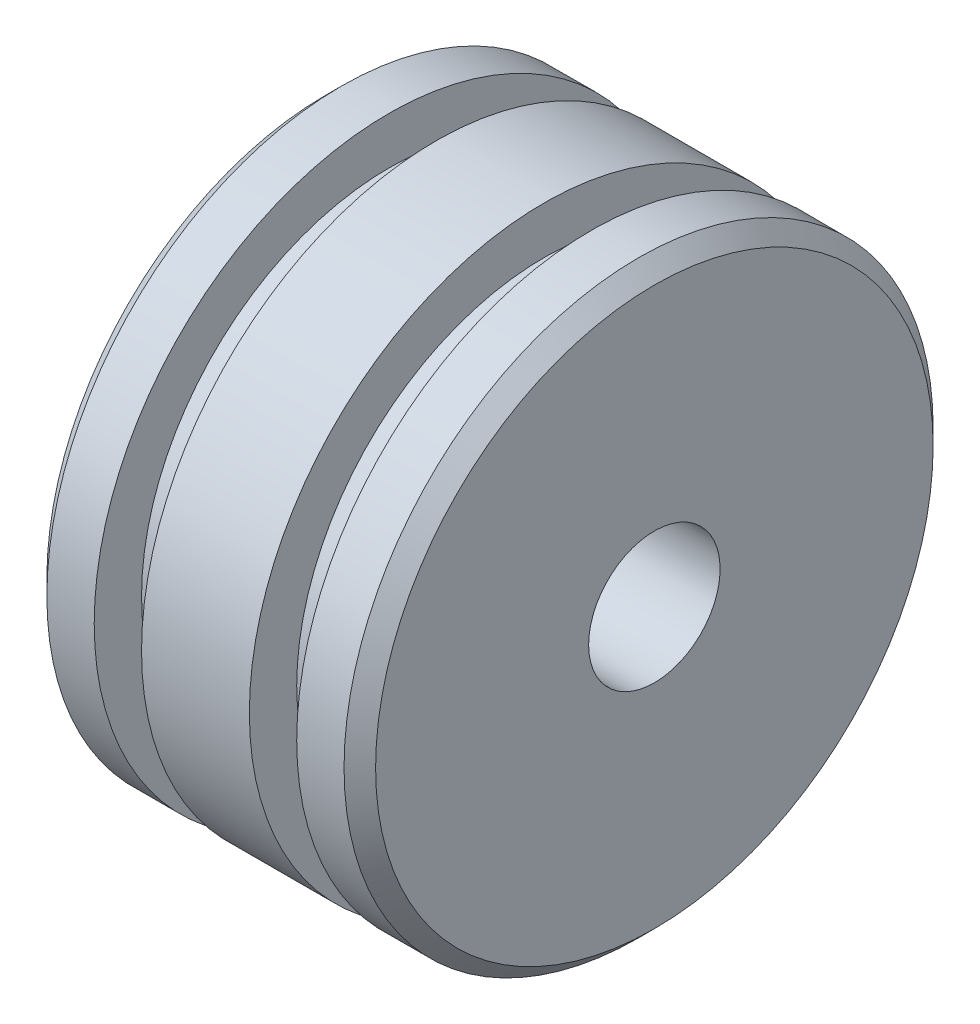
SolidWorks part; units mm, degrees
ref_plane "Front" through (0, 0, 0) normal (0, 0, 1) x (1, 0, 0)
ref_plane "Top" through (0, 0, 0) normal (0, 1, 0) x (1, 0, 0)
ref_plane "Right" through (0, 0, 0) normal (1, 0, 0) x (0, 0, -1)
sketch "Sketch3" plane through (0, 0, 0) normal (1, 0, 0) x (0, 0, -1)
  circle A0 centre (0, 0) radius 14.224
  dimension "D1" = 28.448
extrude "Base-Extrude" add sketch "Sketch3" along normal blind 15.875
sketch "Sketch4" plane through (0, 0, 0) normal (0, 0, 1) x (1, 0, 0)
  line L0 (3.048, 14.224) -> (5.334, 14.224)
  line L1 (3.048, 14.224) -> (3.048, 11.938)
  line L2 (5.334, 11.938) -> (3.048, 11.938)
  line L3 (5.334, 11.938) -> (5.334, 14.224)
  line L4 (15.875, 14.224) -> (0, 14.224) construction
  line L5 (10.541, 14.224) -> (12.827, 14.224)
  line L6 (10.541, 14.224) -> (10.541, 11.938)
  line L7 (12.827, 11.938) -> (10.541, 11.938)
  line L8 (12.827, 11.938) -> (12.827, 14.224)
  line L9 (0, 14.224) -> (0, -14.224) construction
  line L10 (15.875, -14.224) -> (15.875, 14.224) construction
  line L11 (0, 0) -> (18.5148, 0) construction
  line L12 (15.875, 0) -> (0, 0) construction
  dimension "D1" = 3.048
  dimension "D2" = 3.048
  dimension "D3" = 2.286
revolve "Cut-Revolve1" cut sketch "Sketch4" angle 360 about L11
sketch "Sketch5" plane through (0, 0, 0) normal (-1, 0, 0) x (0, 0, 1)
  circle A0 centre (0, 0) radius 3.175
  dimension "D1" = 6.35
extrude "Cut-Extrude1" cut sketch "Sketch5" against normal through all
chamfer "Chamfer1" distance 0.762 angle 45 2 edges at (0, 0, -14.224) (15.875, 0, -14.224)
